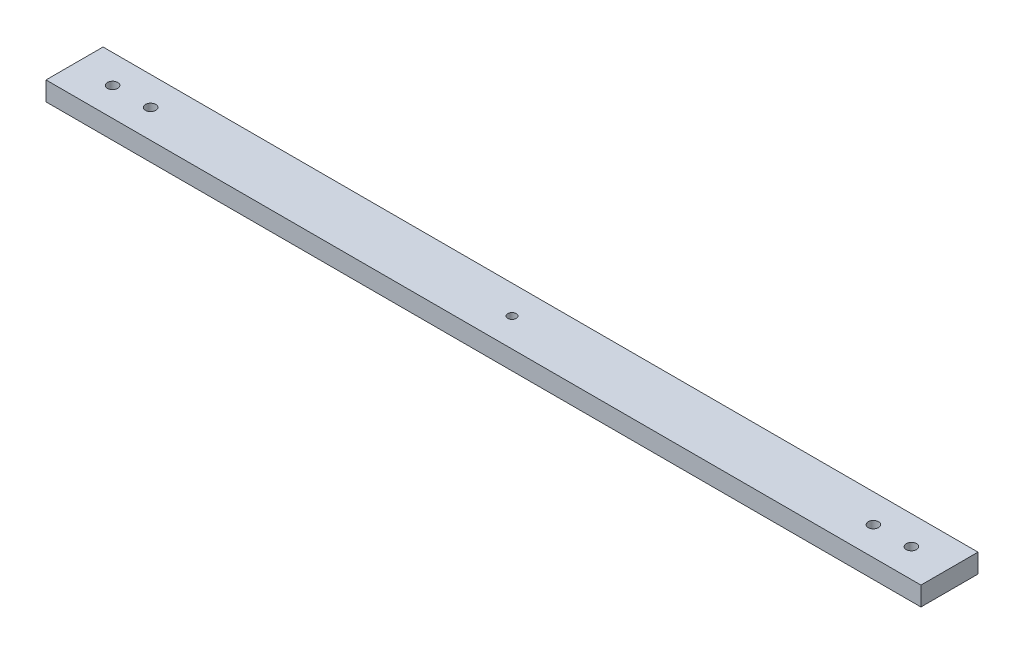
SolidWorks part; units mm, degrees
ref_plane "Front Plane" through (0, 0, 0) normal (0, 0, 1) x (1, 0, 0)
ref_plane "Top Plane" through (0, 0, 0) normal (0, 1, 0) x (1, 0, 0)
ref_plane "Right Plane" through (0, 0, 0) normal (1, 0, 0) x (0, 0, -1)
sketch "Sketch2" plane through (0, 0, 0) normal (0, 1, 0) x (1, 0, 0)
  line L1 (-146.05, -12.7) -> (146.05, -12.7)
  line L2 (-146.05, -12.7) -> (-146.05, 6.35)
  line L3 (-146.05, 6.35) -> (146.05, 6.35)
  line L4 (146.05, -12.7) -> (146.05, 6.35)
  point P0 (0, 0)
  dimension "D1" = 19.05
  dimension "D2" = 146.05
  dimension "D3" = 292.1
extrude "Boss-Extrude1" add sketch "Sketch2" along normal blind 6.35
sketch "Sketch4" plane through (0, 6.35, 0) normal (0, 1, 0) x (1, 0, 0)
  line L0 (0, 6.35) -> (0, -3.175) construction
  line L1 (146.05, 6.35) -> (-146.05, 6.35) construction
  line L3 (-146.05, -3.175) -> (-133.35, -3.175) construction
  line L4 (-146.05, 6.35) -> (-146.05, -12.7) construction
  line L5 (-133.35, -3.175) -> (-120.65, -3.175) construction
  dimension "D1" = 9.525
  dimension "D2" = 12.7
  dimension "D3" = 12.7
  dimension "D4" = 9.525
hole_wizard "#8-32 Tapped Hole1" positions "Sketch6" profile "Sketch7" tap size "#8-32" standard "ANSI Inch"
sketch "Sketch6" plane through (0, 6.35, 0) normal (0, 1, 0) x (1, 0, 0)
  point P0 (-133.35, -3.175)
  point P3 (-120.65, -3.175)
sketch "Sketch7" plane through (-133.35, 6.35, 3.175) normal (1, 0, 0) x (0, 0, 1)
  line L0 (0, 0) -> (0, 6.35)
  line L1 (0, 6.35) -> (1.7272, 6.35)
  line L2 (1.7272, 6.35) -> (1.7272, 0)
  line L5 (1.7272, 0) -> (0, 0)
  line L11 (0, -6.35) -> (0, 107.95) construction
  dimension "Thread Major Dia." = 3.4544
  dimension "Thru Tap Drill Depth" = 6.35
mirror "Mirror1" about plane through (0, 0, 0) normal (1, 0, 0) of "#8-32 Tapped Hole1"
hole_wizard "#4-40 Tapped Hole1" positions "Sketch9" profile "Sketch8" tap size "#4-40" standard "ANSI Inch"
sketch "Sketch9" plane through (0, 6.35, 0) normal (0, 1, 0) x (1, 0, 0)
  point P0 (0, -3.175)
sketch "Sketch8" plane through (0, 6.35, 3.175) normal (1, 0, 0) x (0, 0, 1)
  line L0 (0, 0) -> (0, 6.35)
  line L1 (0, 6.35) -> (1.4224, 6.35)
  line L2 (1.4224, 6.35) -> (1.4224, 0)
  line L5 (1.4224, 0) -> (0, 0)
  line L11 (0, -6.35) -> (0, 107.95) construction
  dimension "Thread Major Dia." = 2.8448
  dimension "Thru Tap Drill Depth" = 6.35
